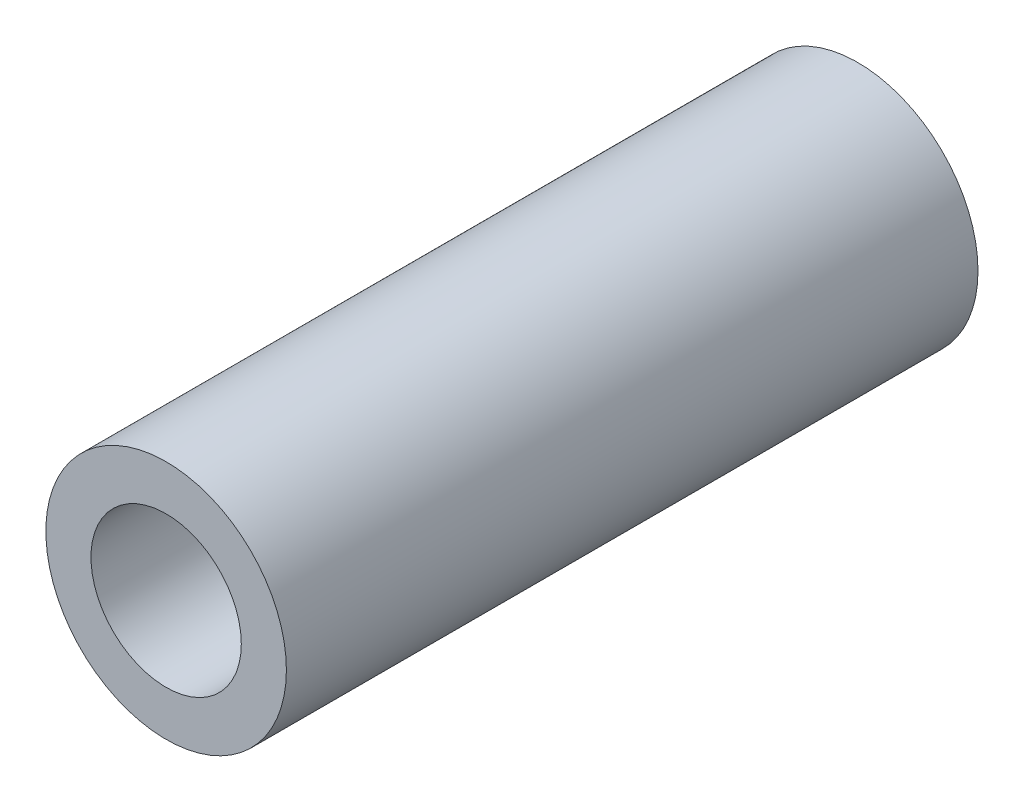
SolidWorks part; units mm, degrees
ref_plane "Alzado" through (0, 0, 0) normal (0, 0, 1) x (1, 0, 0)
ref_plane "Planta" through (0, 0, 0) normal (0, 1, 0) x (1, 0, 0)
ref_plane "Vista lateral" through (0, 0, 0) normal (1, 0, 0) x (0, 0, -1)
sketch "Croquis1" plane through (0, 0, 0) normal (0, 0, 1) x (1, 0, 0)
  circle A0 centre (0, 0) radius 4
  circle A1 centre (0, 0) radius 2.5
  dimension "D1" = 5
  dimension "D2" = 8
extrude "Saliente-Extruir1" add sketch "Croquis1" along normal blind 23
